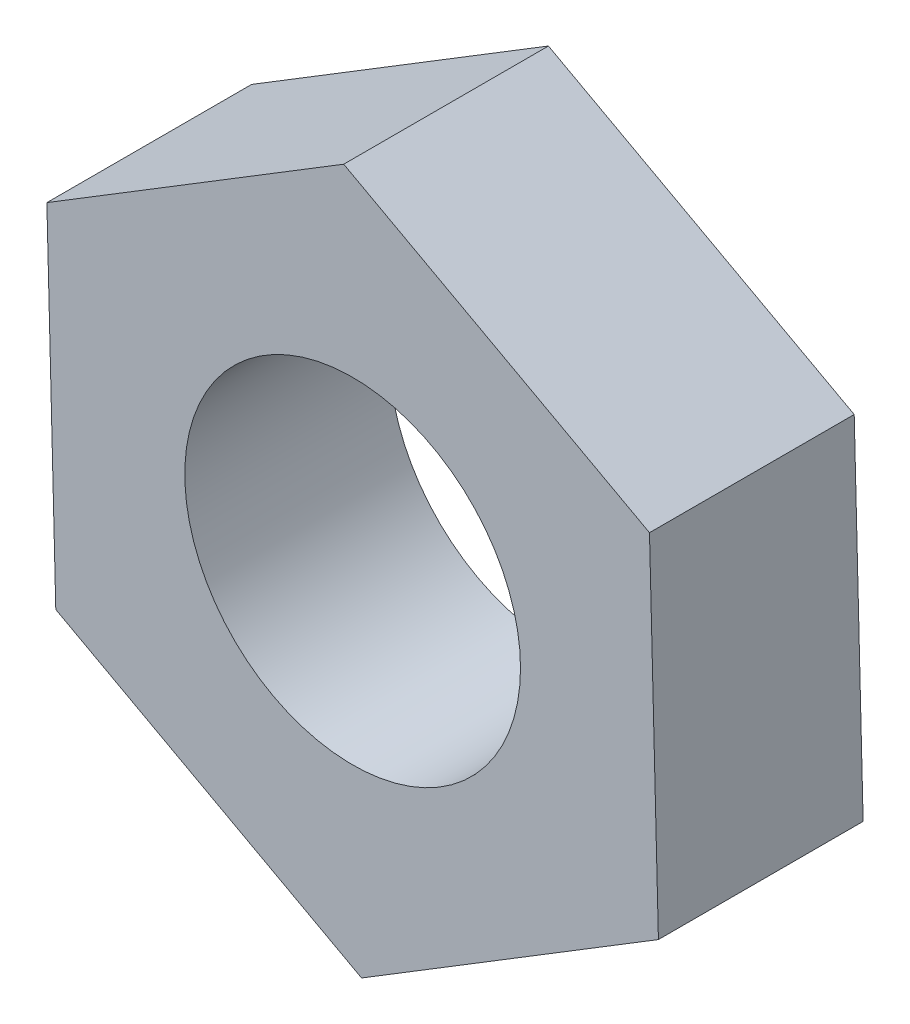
SolidWorks part; units mm, degrees
ref_plane "Front Plane" through (0, 0, 0) normal (0, 0, 1) x (1, 0, 0)
ref_plane "Top Plane" through (0, 0, 0) normal (0, 1, 0) x (1, 0, 0)
ref_plane "Right Plane" through (0, 0, 0) normal (1, 0, 0) x (0, 0, -1)
sketch "Sketch1" plane through (0, 0, 0) normal (0, 0, 1) x (1, 0, 0)
  line L1 (9.2078, 5.6358) -> (-0.2769, 10.7921)
  line L2 (-0.2769, 10.7921) -> (-9.4846, 5.1563)
  line L3 (-9.4846, 5.1563) -> (-9.2078, -5.6358)
  line L4 (-9.2078, -5.6358) -> (0.2769, -10.7921)
  line L5 (0.2769, -10.7921) -> (9.4846, -5.1563)
  line L6 (9.4846, -5.1563) -> (9.2078, 5.6358)
  circle A0 centre (0, 0) radius 9.3493 construction
  circle A1 centre (0, 0) radius 5.207
  dimension "D1" = 10.414
extrude "Extrude1" add sketch "Sketch1" along normal blind 6.35
